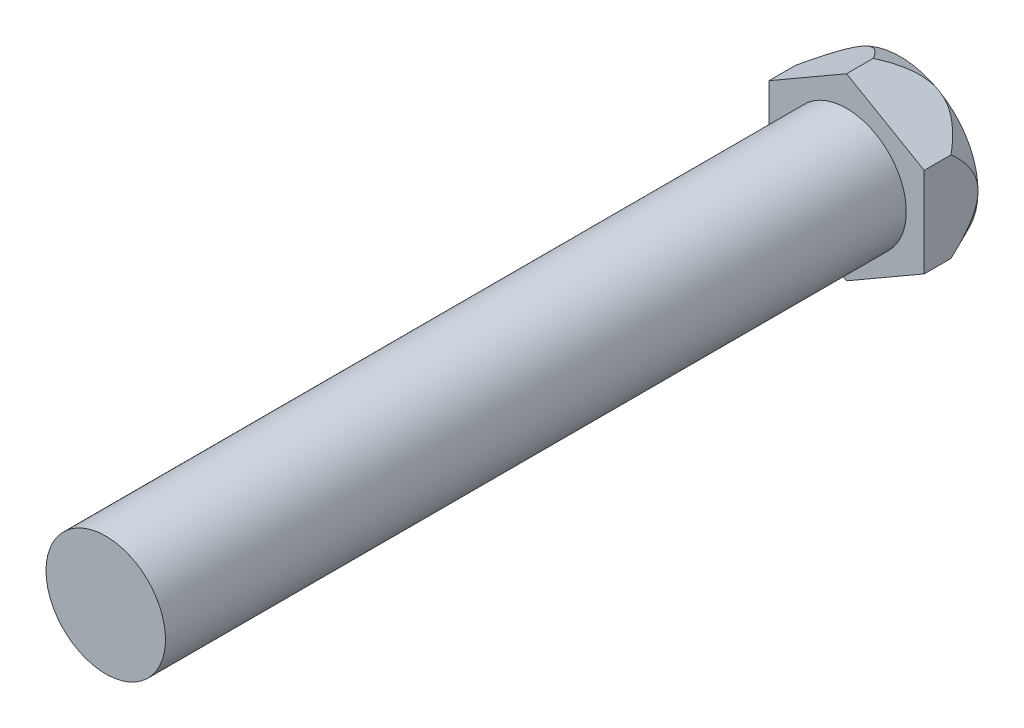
SolidWorks part; units mm, degrees
ref_plane "Front Plane" through (0, 0, 0) normal (0, 0, 1) x (1, 0, 0)
ref_plane "Top Plane" through (0, 0, 0) normal (0, 1, 0) x (1, 0, 0)
ref_plane "Right Plane" through (0, 0, 0) normal (1, 0, 0) x (0, 0, -1)
sketch "Sketch1" plane through (0, 0, 0) normal (0, 0, 1) x (1, 0, 0)
  line L1 (0, 3.0022) -> (-2.6, 1.5011)
  line L2 (-2.6, 1.5011) -> (-2.6, -1.5011)
  line L3 (-2.6, -1.5011) -> (0, -3.0022)
  line L4 (0, -3.0022) -> (2.6, -1.5011)
  line L5 (2.6, -1.5011) -> (2.6, 1.5011)
  line L6 (2.6, 1.5011) -> (0, 3.0022)
  circle A0 centre (0, 0) radius 2.6 construction
extrude "Boss-Extrude1" add sketch "Sketch1" along normal blind 1.8
sketch "Sketch2" plane through (0, 0, 0) normal (0, 0, -1) x (-1, 0, 0)
  circle A0 centre (0, 0) radius 2.6
extrude "Cut-Extrude1" cut sketch "Sketch2" against normal through all draft 24 flip side to cut
sketch "Sketch3" plane through (0, 0, 1.8) normal (0, 0, 1) x (1, 0, 0)
  circle A0 centre (0, 0) radius 2
extrude "Boss-Extrude2" add sketch "Sketch3" along normal blind 24.8
